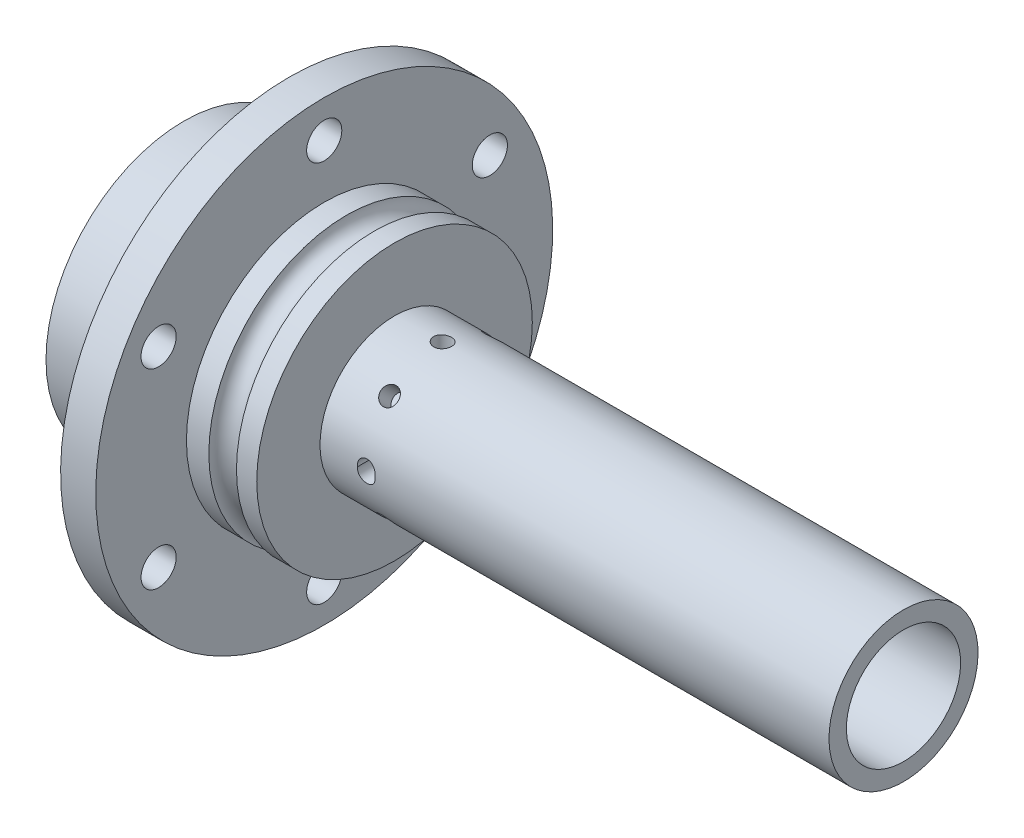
SolidWorks part; units mm, degrees
ref_plane "Front Plane" through (0, 0, 0) normal (0, 0, 1) x (1, 0, 0)
ref_plane "Top Plane" through (0, 0, 0) normal (0, 1, 0) x (1, 0, 0)
ref_plane "Right Plane" through (0, 0, 0) normal (1, 0, 0) x (0, 0, -1)
sketch "Sketch1" plane through (0, 0, 0) normal (0, 0, 1) x (1, 0, 0)
  line L0 (-0.3227, 0.508) -> (-0.3227, 25.4)
  line L1 (-0.3227, 25.4) -> (18.6965, 25.4)
  line L2 (18.6965, 25.4) -> (18.6965, 41.783)
  line L3 (18.6965, 41.783) -> (25.0465, 41.783)
  line L4 (25.0465, 41.783) -> (25.0465, 25.4)
  line L5 (25.0465, 25.4) -> (29.0895, 25.4)
  line L6 (37.7465, 25.4) -> (37.7465, 0.508)
  line L7 (37.7465, 0.508) -> (-0.3227, 0.508)
  line L8 (34.0815, 25.4) -> (37.7465, 25.4)
  arc A0 (34.0815, 25.4) -> (29.0895, 25.4) centre (31.5855, 25.5034) cw
  dimension "D7" = 2.4981
  dimension "D1" = 24.892
  dimension "D2" = 41.275
  dimension "D3" = 6.35
  dimension "D4" = 12.7
  dimension "D5" = 19.0192
  dimension "D6" = 38.0692
revolve "Revolve1" add sketch "Sketch1" angle 360 about L7
sketch "Sketch6" plane through (37.7465, 0, 0) normal (1, 0, 0) x (0, 0, -1)
  circle A0 centre (0, 0.508) radius 13.462
  circle A2 centre (0, 0.508) radius 24.892 construction
  dimension "D1" = 26.924
extrude "Boss-Extrude2" add sketch "Sketch6" along normal blind 91.948 contours A0
sketch "Sketch7" plane through (129.6945, 0, 0) normal (1, 0, 0) x (0, 0, -1)
  circle A0 centre (0, 0.508) radius 10.3187
  circle A1 centre (0, 0.508) radius 13.462 construction
  dimension "D1" = 20.6375
extrude "Cut-Extrude3" cut sketch "Sketch7" against normal through all
sketch "Sketch8" plane through (-0.3227, 0, 0) normal (-1, 0, 0) x (0, 0, 1)
  circle A0 centre (0, 0.508) radius 12.7
  circle A1 centre (0, 0.508) radius 24.892 construction
  dimension "D1" = 25.4
extrude "Cut-Extrude4" cut sketch "Sketch8" against normal blind 19.05
sketch "Sketch10" plane through (0, 0, 0) normal (0, 0, 1) x (1, 0, 0)
  line L0 (0, 0) -> (129.6945, 0.508) construction
  line L1 (129.6945, -12.954) -> (129.6945, 13.97) construction
  circle A0 centre (46.1079, 0.1806) radius 1.5875
  dimension "D1" = 3.175
extrude "Cut-Extrude5" cut sketch "Sketch10" against normal through all both and the other way through all
pattern_circular "CirPattern1" count 6 every 45 about axis through (129.6945, 0.508, 0) along (1, 0, 0) of "Cut-Extrude5"
sketch "Sketch12" plane through (-0.3227, 0, 0) normal (-1, 0, 0) x (0, 0, 1)
  circle A0 centre (0, 19.05) radius 2.032
  dimension "D1" = 4.064
  dimension "D2" = 19.05
extrude "Cut-Extrude7" cut sketch "Sketch12" against normal blind 6.35
pattern_circular "CirPattern3" count 6 over 360 about axis through (0, 0.508, 0) along (1, 0, 0) of "Cut-Extrude7"
sketch "Sketch13" plane through (18.6965, 0, 0) normal (-1, 0, 0) x (0, 0, 1)
  circle A0 centre (0, 35.052) radius 3.175
  dimension "D1" = 6.35
  dimension "D2" = 35.052
extrude "Cut-Extrude8" cut sketch "Sketch13" against normal through all and the other way through all
pattern_circular "CirPattern4" count 6 over 360 about axis through (0, 0.508, 0) along (1, 0, 0) of "Cut-Extrude8"
